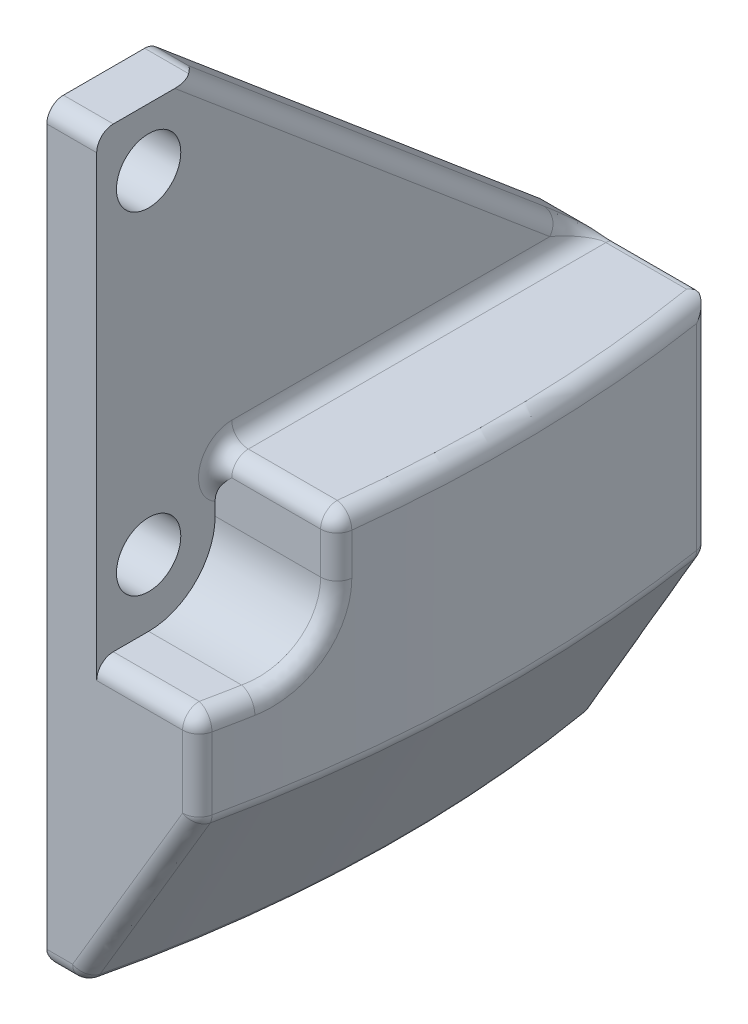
SolidWorks part; units mm, degrees
ref_plane "Front Plane" through (0, 0, 0) normal (0, 0, 1) x (1, 0, 0)
ref_plane "Top Plane" through (0, 0, 0) normal (0, 1, 0) x (1, 0, 0)
ref_plane "Right Plane" through (0, 0, 0) normal (1, 0, 0) x (0, 0, -1)
ref_plane "Plane1" through (85.2487, 0, 0) normal (1, 0, 0) x (0, 0, -1)
sketch "Sketch4" plane through (85.2487, 0, 0) normal (1, 0, 0) x (0, 0, -1)
  line L0 (-21.7488, 57.15) -> (-21.7488, 0)
  line L1 (-21.7488, 0) -> (16.3512, 0)
  line L2 (16.3512, 0) -> (16.3512, 31.75)
  line L3 (16.3512, 31.75) -> (-13.8113, 57.15)
  line L4 (-13.8113, 57.15) -> (-21.7488, 57.15)
  line L5 (-21.7488, -11.9063) -> (-21.7488, 277.495) construction
  dimension "D1" = 7.9375
  dimension "D2" = 57.15
  dimension "D3" = 31.75
  dimension "D4" = 38.1
extrude "Boss-Extrude1" add sketch "Sketch4" along normal blind 3.81
sketch "Sketch5" plane through (0, 0, 0) normal (0, -1, 0) x (1, 0, 0)
  line L0 (89.0587, 21.7488) -> (85.2487, 21.7488) construction
  line L1 (89.0587, -16.3512) -> (108.1087, -16.3512)
  line L2 (89.0587, -16.3512) -> (89.0587, 21.7488)
  line L3 (89.0587, 21.7488) -> (108.1087, 21.7488)
  line L4 (108.1087, -16.3512) -> (108.1087, 21.7488)
  dimension "D1" = 19.05
extrude "Boss-Extrude2" add sketch "Sketch5" against normal up to vertex
sketch "Sketch6" plane through (0, 0, 0) normal (0, 0, 1) x (1, 0, 0)
  line L0 (99.06, 15.123) -> (99.06, 31.75)
  line L4 (99.06, 15.123) -> (90.3287, 0)
  line L6 (108.1087, 0) -> (85.2487, 0) construction
  line L7 (0, 0) -> (0, 47.0612) construction
  line L8 (90.3287, 0) -> (111.76, 0)
  line L9 (111.76, 0) -> (111.76, 31.75)
  line L10 (111.76, 31.75) -> (99.06, 31.75)
  line L11 (89.0587, 31.75) -> (108.1087, 31.75) construction
  line L12 (89.0587, 31.75) -> (89.0587, 57.15) construction
  dimension "D1" = 198.12
  dimension "D2" = 1.27
  dimension "D3" = 60
  dimension "D4" = 12.7
revolve "Cut-Revolve1" cut sketch "Sketch6" angle 360 about L7
hole_wizard "#10 (0.1935) Diameter Hole2" positions "Sketch10" profile "Sketch9" hole size "#10" standard "ANSI Inch"
sketch "Sketch10" plane through (85.2487, 0, 0) normal (-1, 0, 0) x (0, 0, 1)
  line L0 (13.8113, 57.15) -> (21.7488, 57.15) construction
  line L1 (21.7488, 57.15) -> (21.7488, 31.75) construction
  point P0 (17.78, 27.305)
  point P2 (17.78, 52.705)
  point P11 (0, 0)
  dimension "D1" = 25.4
  dimension "D2" = 4.445
  dimension "D3" = 3.9688
sketch "Sketch9" plane through (85.2487, 27.305, 17.78) normal (0, 1, 0) x (0, 0, 1)
  line L0 (0, 0) -> (0, 13.8113)
  line L1 (0, 13.8113) -> (2.4574, 13.8113)
  line L2 (2.4574, 13.8113) -> (2.4574, 0)
  line L5 (2.4574, 0) -> (0, 0)
  line L11 (0, -6.35) -> (0, 107.95) construction
  dimension "Thru Hole Dia." = 4.9149
  dimension "Thru Hole Depth" = 13.8113
ref_plane "Plane2" through (99.06, 0, 0) normal (1, 0, 0) x (0, 0, -1)
sketch "Sketch11" plane through (99.06, 0, 0) normal (1, 0, 0) x (0, 0, -1)
  line L0 (16.3512, 31.75) -> (-21.7488, 31.75) construction
  line L1 (-21.7488, 31.75) -> (-21.7488, 22.225)
  line L2 (-21.7488, 22.225) -> (-17.78, 22.225)
  line L3 (-21.7488, 15.123) -> (-21.7488, 31.75) construction
  line L4 (-12.7, 27.305) -> (-12.7, 31.75)
  line L5 (-12.7, 31.75) -> (-21.7488, 31.75)
  arc A0 (-17.78, 22.225) -> (-12.7, 27.305) centre (-17.78, 27.305) ccw
  dimension "D1" = 10.16
extrude "Cut-Extrude1" cut sketch "Sketch11" against normal up to surface (10.0013 mm away)
fillet "Fillet1" radius 1.27 20 edges at (98.2425, 29.5275, 12.7) (97.0674, 22.225, 19.7685) (98.0946, 24.1534, 13.7958) (97.7012, 23.4365, -16.3512) (96.643, 18.674, 21.7488) (86.4601, 0, 21.7488) (87.0426, 0, -16.3512) (87.1537, 57.15, 13.8113) (87.1537, 57.15, 21.7488) (92.8509, 22.225, 21.7488) (93.6506, 31.75, 12.7) (85.2487, 0, 2.6988) (90.2865, 0, 2.7609) (87.1537, 31.75, -16.3512) (99.0218, 15.123, 2.7501) (99.0428, 31.75, -1.8456) (89.0587, 44.45, -1.27)
ref_plane "Plane3" through (0, 52.705, 0) normal (0, 1, 0) x (1, 0, 0)
